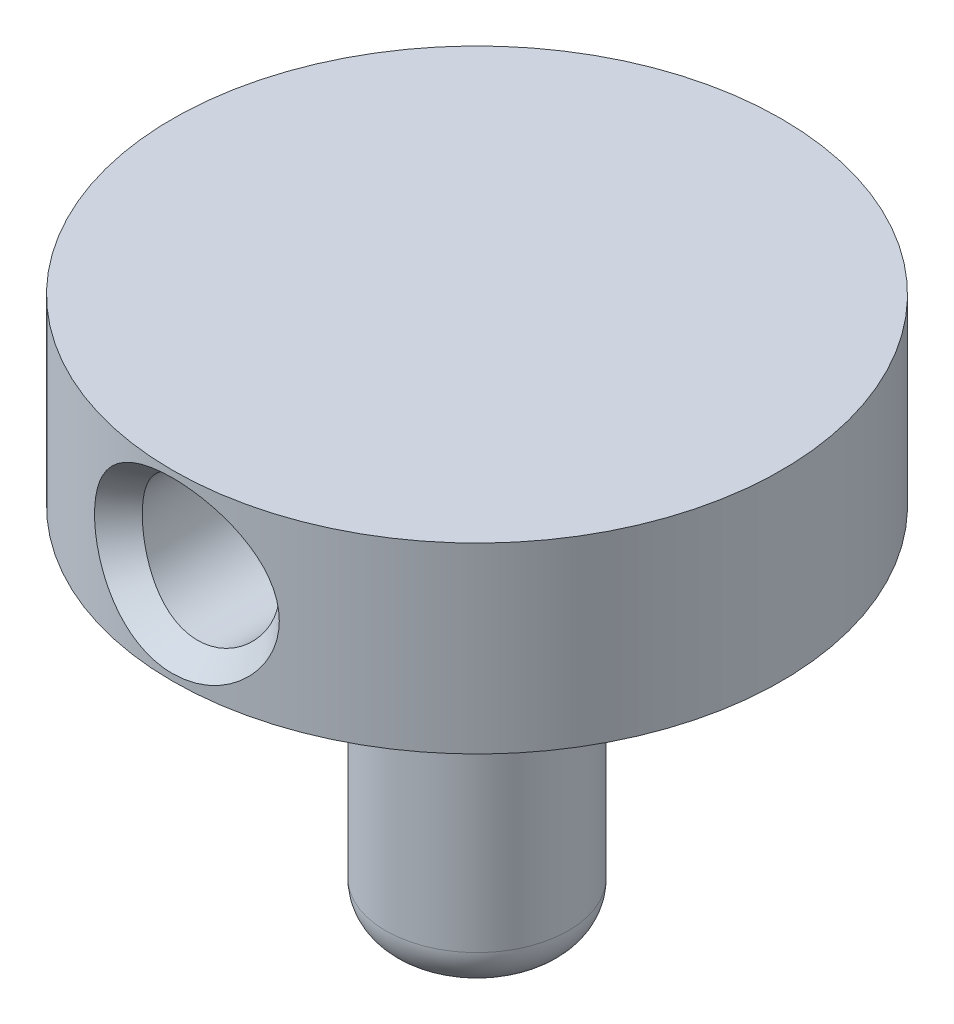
SolidWorks part; units mm, degrees
ref_plane "Front Plane" through (0, 0, 0) normal (0, 0, 1) x (1, 0, 0)
ref_plane "Top Plane" through (0, 0, 0) normal (0, 1, 0) x (1, 0, 0)
ref_plane "Right Plane" through (0, 0, 0) normal (1, 0, 0) x (0, 0, -1)
sketch "Sketch1" plane through (0, 0, 0) normal (0, 1, 0) x (1, 0, 0)
  circle A0 centre (0, 0) radius 1.905
  dimension "D1" = 3.81
extrude "Boss-Extrude1" add sketch "Sketch1" along normal blind 7.62
sketch "Sketch2" plane through (0, 7.62, 0) normal (0, 1, 0) x (1, 0, 0)
  circle A0 centre (0, 0) radius 6.35
  dimension "D1" = 12.7
extrude "Boss-Extrude2" add sketch "Sketch2" along normal blind 3.81
chamfer "Chamfer1" distance 0.889 angle 45 1 edges at (0, 7.62, 1.905)
fillet "Fillet1" radius 0.889 1 edges at (0, 0, 1.905)
ref_plane "Plane1" through (0, 0, 6.35) normal (0, 0, 1) x (1, 0, 0)
sketch "Sketch3" plane through (0, 0, 6.35) normal (0, 0, 1) x (1, 0, 0)
  line L0 (0, 11.43) -> (0, 7.62) construction
  line L1 (6.35, 11.43) -> (-6.35, 11.43) construction
  line L2 (-2.794, 7.62) -> (2.794, 7.62) construction
  circle A0 centre (0, 9.525) radius 1.4287
  point P4 (0, 7.62)
  dimension "D1" = 2.8575
extrude "Cut-Extrude2" cut sketch "Sketch3" against normal blind 3.175 contours A0
ref_plane "Plane2" through (0, 0, -6.35) normal (0, 0, -1) x (-1, 0, 0)
sketch "Sketch4" plane through (0, 0, -6.35) normal (0, 0, -1) x (-1, 0, 0)
  line L0 (0, 11.43) -> (0, 7.62) construction
  line L1 (6.35, 11.43) -> (-6.35, 11.43) construction
  line L2 (-2.794, 7.62) -> (2.794, 7.62) construction
  circle A0 centre (0, 9.525) radius 1.4287
  point P6 (0, 9.525)
  dimension "D1" = 2.8575
extrude "Cut-Extrude3" cut sketch "Sketch4" against normal blind 3.175 contours A0
chamfer "Chamfer3" distance 0.635 angle 45 2 edges at (-1.3992, 9.8138, 6.1939) (0.2886, 8.1257, -6.3434)
